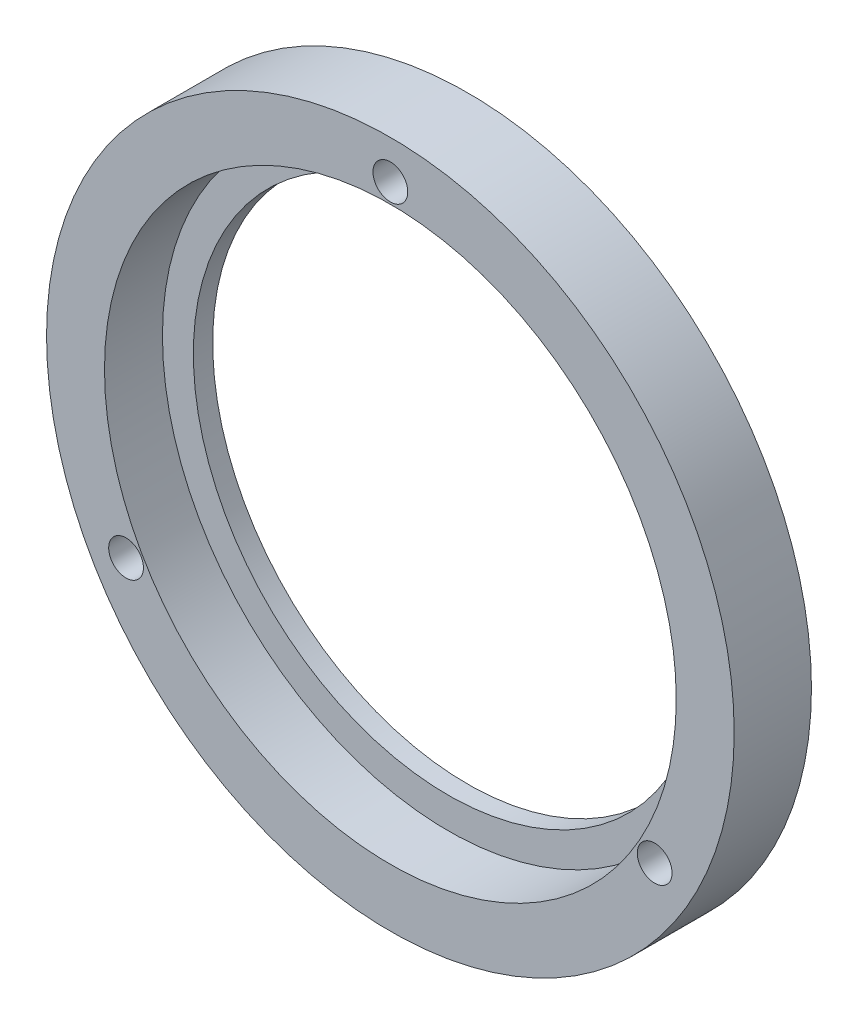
SolidWorks part; units mm, degrees
ref_plane "Plan1" through (0, 0, 0) normal (0, 0, 1) x (1, 0, 0)
ref_plane "Plan2" through (0, 0, 0) normal (0, 1, 0) x (1, 0, 0)
ref_plane "Plan3" through (0, 0, 0) normal (1, 0, 0) x (0, 0, -1)
sketch "Esquisse1" plane through (0, 0, 0) normal (0, 1, 0) x (1, 0, 0)
  line L0 (0, -30) -> (0, 40) construction
  line L1 (33, 10) -> (44.5, 10)
  line L2 (44.5, 10) -> (44.5, 0)
  line L3 (44.5, 0) -> (37, 0)
  line L4 (37, 0) -> (37, 7.5)
  line L5 (37, 7.5) -> (33, 7.5)
  line L6 (33, 7.5) -> (33, 10)
  dimension "D1" = 66
  dimension "D2" = 89
  dimension "D3" = 7.5
  dimension "D4" = 10
  dimension "D5" = 74
revolve "Base-Révolution" add sketch "Esquisse1" angle 360 about L0
sketch "Esquisse2" plane through (0, 0, 0) normal (0, 0, 1) x (1, 0, 0)
  line L0 (0, 0) -> (0, 45.4042) construction
  circle A0 centre (0, 0) radius 39.5 construction
  circle A1 centre (0, 39.5) radius 2.25
  dimension "D1" = 4.5
  dimension "D2" = 79
extrude "Enlèv. mat.-Extru.1" cut sketch "Esquisse2" against normal through all
pattern_circular "Répétition circulaire1" count 3 every 120 about axis through (0, 0, 30) along (0, 0, -1)
sketch "Esquisse3" plane through (0, 0, 0) normal (1, 0, 0) x (0, 0, -1)
  line L0 (0, -44.5) -> (10, -44.5)
  line L1 (0, -44.5) -> (10, -44.5)
  line L2 (10, 44.5) -> (0, 44.5)
  line L3 (10, 44.5) -> (0, 44.5)
  point P0 (104.7866, 26.86)
